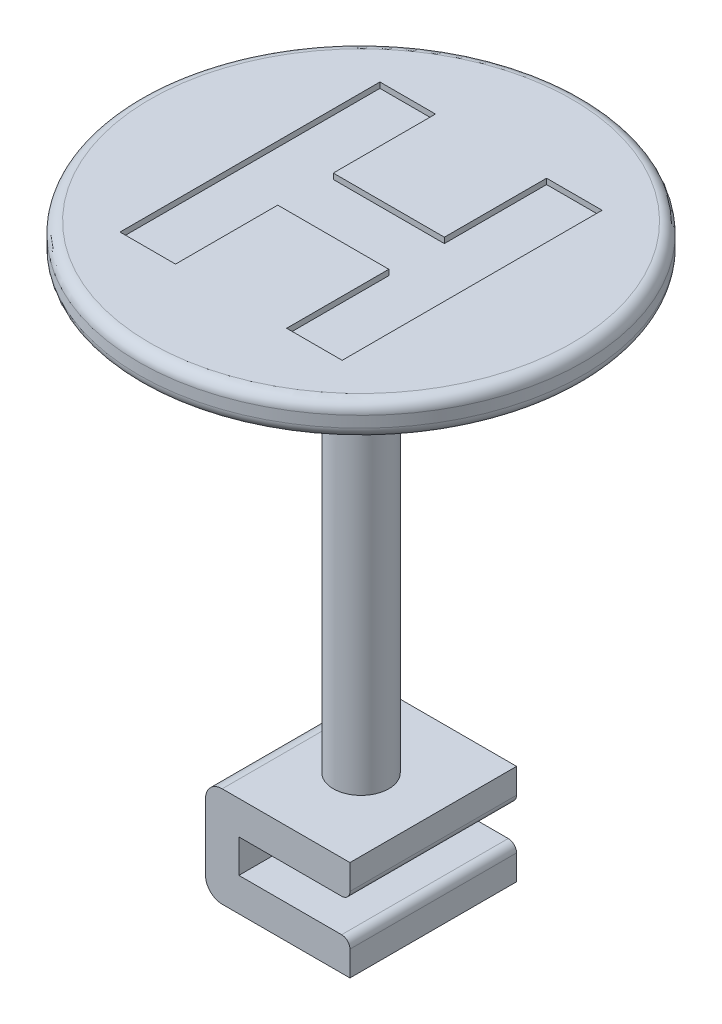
SolidWorks part; units mm, degrees
ref_plane "Front" through (0, 0, 0) normal (0, 0, 1) x (1, 0, 0)
ref_plane "Top" through (0, 0, 0) normal (0, 1, 0) x (1, 0, 0)
ref_plane "Right" through (0, 0, 0) normal (1, 0, 0) x (0, 0, -1)
sketch "Sketch2" plane through (0, 0, 0) normal (0, 0, 1) x (1, 0, 0)
  line L0 (-3, 6) -> (10, 6)
  line L1 (0, 0) -> (10, 0)
  line L2 (0, 0) -> (0, 3)
  line L3 (0, 3) -> (10, 3)
  line L6 (-3, -3) -> (10, -3)
  line L7 (-3, -3) -> (-3, 6)
  line L8 (10, 3) -> (10, 6)
  line L9 (10, 0) -> (10, -3)
  line L10 (-3, 6) -> (13, 6) construction
  line L11 (-3, -3) -> (13, -3) construction
  line L12 (10, 0) -> (10, 3) construction
  line L13 (13, -3) -> (13, 6) construction
extrude "Extrude1" add sketch "Sketch2" along normal blind 15
fillet "Fillet2" radius 0.75 2 edges at (10, 0, 7.5) (10, 3, 7.5)
sketch "Sketch4" plane through (0, 6, 0) normal (0, 1, 0) x (-1, 0, 0)
  circle A0 centre (-3.5, 7.5) radius 2.5
extrude "Extrude2" add sketch "Sketch4" along normal blind 40
sketch "Sketch6" plane through (0, 46, 0) normal (0, 1, 0) x (-1, 0, 0)
  circle A0 centre (-3.5, 7.5) radius 20
extrude "Extrude3" add sketch "Sketch6" along normal blind 3
sketch "Sketch7" plane through (0, 49, 0) normal (0, 1, 0) x (-1, 0, 0)
  line L0 (-8.5, 10) -> (1.5, 10)
  line L1 (1.5, -4.1989) -> (6.5, -4.1989)
  line L2 (6.5, 19.1989) -> (6.5, -4.1989)
  line L3 (1.5, 5) -> (-8.5, 5)
  line L4 (-13.5, -4.1989) -> (-13.5, 19.1989)
  line L5 (1.5, 19.1989) -> (1.5, 10)
  line L8 (1.5, 19.1989) -> (6.5, 19.1989)
  line L10 (-8.5, -4.1989) -> (-13.5, -4.1989)
  line L12 (1.5, -4.1989) -> (1.5, 5)
  line L16 (-8.5, -4.1989) -> (-8.5, 5)
  line L19 (-8.5, 19.1989) -> (-13.5, 19.1989)
  line L20 (-8.5, 19.1989) -> (-8.5, 10)
extrude "Cut-Extrude1" cut sketch "Sketch7" against normal blind 0.5
fillet "Fillet3" radius 1.5 2 edges at (-3, -3, 7.5) (-3, 6, 7.5)
fillet "Fillet4" radius 1 2 edges at (3.5, 46, 27.5) (3.5, 49, 27.5)
